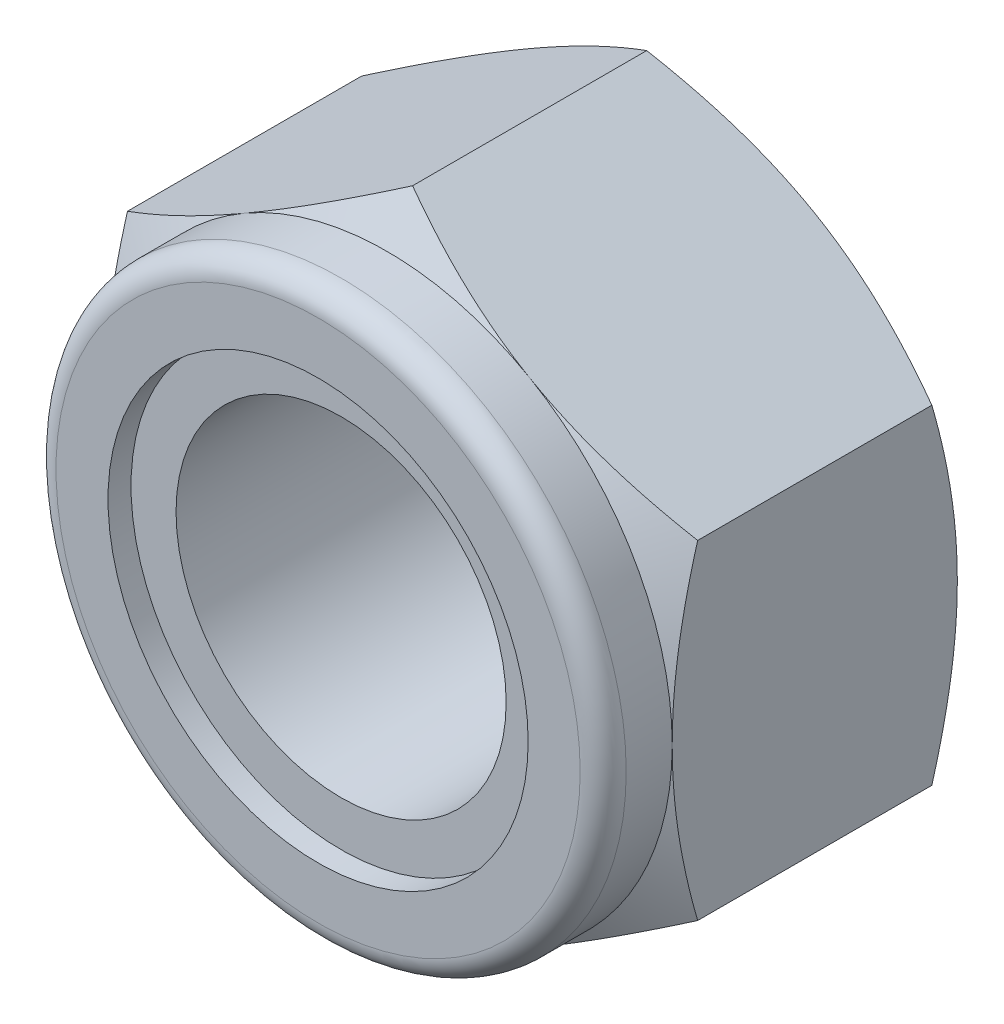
SolidWorks part; units mm, degrees
extrude "BaseNut" add sketch "BaseNutSke" against normal blind 9.5
sketch "BaseNutSke" plane through (0, 0, 0) normal (0, 0, 1) x (1, 0, 0)
  line L6 (9.5, 5.4848) -> (9.5, -5.4848)
  line L7 (-9.5, 5.4848) -> (-9.5, -5.4848)
  line L8 (9.5, 5.4848) -> (0, 10.9697)
  line L9 (0, 10.9697) -> (-9.5, 5.4848)
  line L10 (-9.5, -5.4848) -> (0, -10.9697)
  line L11 (0, -10.9697) -> (9.5, -5.4848)
  circle A0 centre (0, 0) radius 5.5
  circle A1 centre (0, 0) radius 6 construction
revolve "TorqueElement" add sketch "TorElSke"
sketch "TorElSke"
  line L0 (-9.4809, 0) -> (15.875, 0) construction
  line L1 (9.1245, 0) -> (0.3501, 0) construction
  line L2 (-1.5333, 5.5) -> (4.75, 5.5)
  line L3 (4.75, 5.5) -> (4.75, 9.5)
  line L4 (4.75, 9.5) -> (-1.5333, 9.5)
  line L5 (-1.5333, 5.5) -> (-1.5333, 7)
  line L6 (-1.5333, 7) -> (-2.3, 7)
  line L7 (-2.3, 7) -> (-2.3, 8.7333)
  line L8 (9.5, 0) -> (9.5, 8.2272) construction
  arc A0 (-2.3, 8.7333) -> (-1.5333, 9.5) centre (-1.5333, 8.7333) cw
revolve "EndChamfer" cut sketch "Sketch5"
sketch "Sketch5"
  line L0 (9.4746, 6) -> (9.0895, 5.45)
  line L1 (9.5254, 6) -> (9.4746, 6)
  line L2 (9.5254, 6) -> (9.5254, 5.45)
  line L3 (9.5254, 5.45) -> (9.0895, 5.45)
  line L6 (-0.0508, 6) -> (0, 6)
  line L7 (0, 6) -> (0.3851, 5.45)
  line L9 (0.3851, 5.45) -> (-0.0508, 5.45)
  line L10 (-0.0508, 5.45) -> (-0.0508, 6)
  line L11 (25.0375, 0) -> (38.388, 0) construction
  line L12 (9.5, 0) -> (0, 0) construction
pattern_linear "ThdSchPat" [suppressed]
revolve "ThreadSchematic" cut sketch "ThdSchSke" angle 360 about L11
sketch "ThdSchSke" plane through (0, 0, 0) normal (0, 1, 0) x (1, 0, 0)
  line L0 (-6, -1.5333) -> (-5.5, -1.1832)
  line L1 (-5.5, -1.1832) -> (-2.75, -1.1832)
  line L2 (-2.75, -1.1832) -> (-2.75, -1.8834)
  line L3 (-2.75, -1.8834) -> (-5.5, -1.8834)
  line L4 (-5.5, -1.8834) -> (-6, -1.5333)
  line L5 (-3.175, -1.6583) -> (3.175, -1.6583) construction
  line L6 (0, -0.0333) -> (0, -38.1) construction
  line L7 (0, 9.1245) -> (0, -1.5333) construction
  line L8 (9.5, -1.5333) -> (-9.5, -1.5333) construction
  line L9 (0, 9.1245) -> (0, -1.5333) construction
  dimension "D1" = 35
  dimension "Num_threads" = 9
  dimension "Advance" = 1.5726
  dimension "D2" = 0.0508
  dimension "D4" = 50
  dimension "Offset1" = 9.5254
  dimension "ThreadMajor" = 6
  dimension "ChamferDepth" = 0.55
  dimension "Offset2" = 9.5762
revolve "Double-Chamfer" cut sketch "Sketch3" angle 360 about L7
sketch "Sketch3" plane through (0, 0, 0) normal (1, 0, 0) x (0, 0, -1)
  line L0 (9.5, 9.5) -> (8.6515, 10.9697)
  line L1 (8.6515, 10.9697) -> (8.6515, 20.9697)
  line L2 (8.6515, 20.9697) -> (19.5, 20.9697)
  line L3 (19.5, 20.9697) -> (19.5, 9.5)
  line L4 (19.5, 9.5) -> (9.5, 9.5)
  line L5 (9.5, 5.4848) -> (9.5, 10.9697) construction
  line L6 (9.5, 10.9697) -> (0, 10.9697) construction
  line L7 (0, 0) -> (38.6776, 0) construction
  line L8 (9.5, 0) -> (0, 0) construction
  line L9 (4.75, 10.9697) -> (4.75, 44.222) construction
  line L10 (0.8485, 20.9697) -> (-10, 20.9697)
  line L11 (-10, 20.9697) -> (-10, 9.5)
  line L12 (-10, 9.5) -> (0, 9.5)
  line L13 (0, 9.5) -> (0.8485, 10.9697)
  line L14 (0.8485, 10.9697) -> (0.8485, 20.9697)
  line L16 (9.5, 10.9697) -> (0, 10.9697) construction
ref_plane "Plane1" through (0, 0, 0) normal (0, 0, 1) x (1, 0, 0)
ref_plane "Plane2" through (0, 0, 0) normal (0, 1, 0) x (1, 0, 0)
ref_plane "Plane3" through (0, 0, 0) normal (1, 0, 0) x (0, 0, -1)
thread "Filetage1" pitch 1.75 start angle 0, offset 5, length 20, pitch 1.75, diameter 11
ref_plane "Plan1" through (5.5, 0, -14.1245) normal (0, -1, 0) x (1, 0, 0)
sketch "Profil de filetage1" plane through (5.5, 0, -14.1245) normal (0, -1, 0) x (1, 0, 0)
  line L0 (0, 0) -> (0, 1.75) construction
  line L1 (0, 0) -> (0.9472, 0.5469)
  line L2 (0.9472, 0.5469) -> (0.9472, 0.7656)
  line L3 (0.9472, 0.7656) -> (0, 1.3125)
  line L4 (0.9472, 0.6562) -> (0, 0.6562) construction
  line L11 (0, 0) -> (0, 1.3125)
  point P2 (0, 0)
  dimension "Pitch" = 1.75
  dimension "Profile_Angle" = 60
  dimension "Profile_Land" = 0.2188
  dimension "Profile_Height" = 0.9472
equation "\"D2@BaseNutSke\" = \"Width_flats@BaseNutSke\" / 2"
equation "\"D3@BaseNutSke\" = \"Width_flats@BaseNutSke\" / 2"
equation "\"D4@BaseNutSke\" = \"D3@BaseNutSke\""
equation "\"D1@Sketch3\" = \"Width_flats@BaseNutSke\" /2"
equation "\"Thread_major@ThdSchSke\" = \"Major_thd@BaseNutSke\""
equation "\"Tap_Drill@ThdSchSke\" = \"Tap_drill@BaseNutSke\""
equation "\"OverCut@ThdSchSke\" = \"Tap_Drill@ThdSchSke\" * 0.5"
